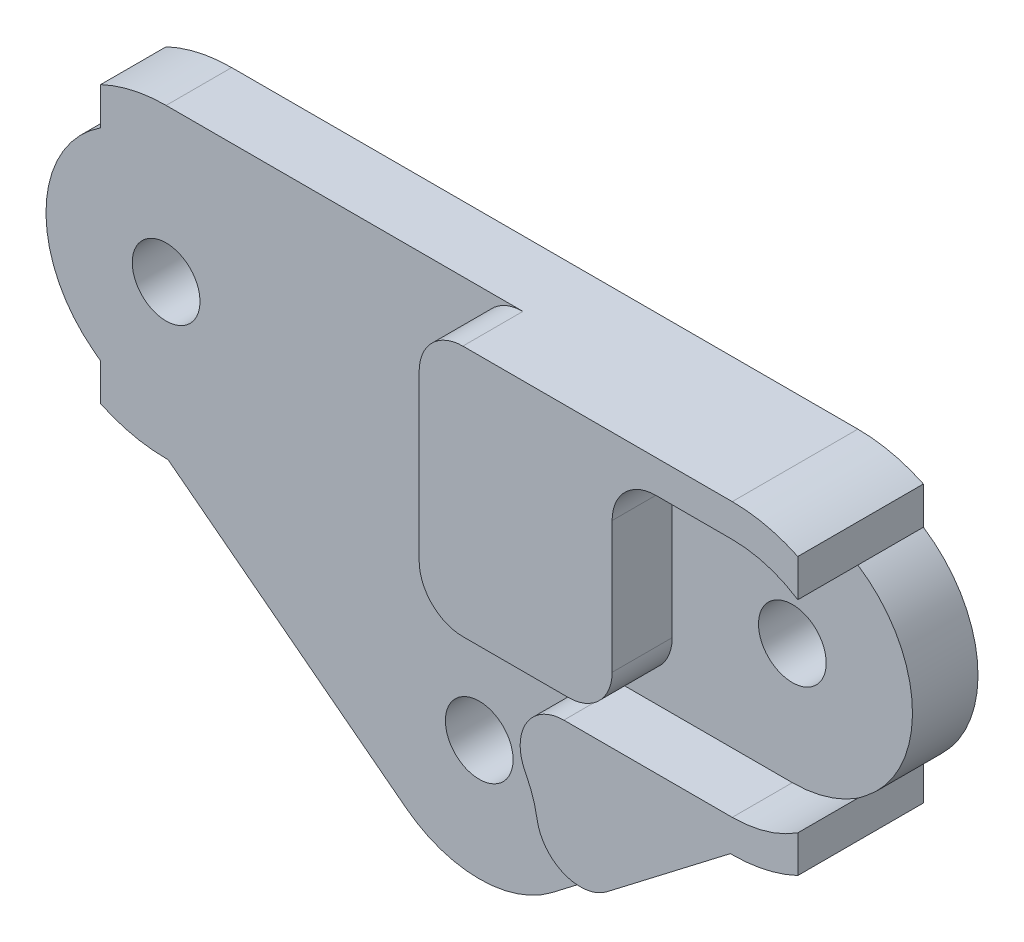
SolidWorks part; units mm, degrees
ref_plane "Front Plane" through (0, 0, 0) normal (0, 0, 1) x (1, 0, 0)
ref_plane "Top Plane" through (0, 0, 0) normal (0, 1, 0) x (1, 0, 0)
ref_plane "Right Plane" through (0, 0, 0) normal (1, 0, 0) x (0, 0, -1)
sketch "Sketch1" plane through (0, 0, 0) normal (0, 0, 1) x (1, 0, 0)
  line L0 (0, 0) -> (14.3333, 0) construction
  line L1 (0, 0) -> (0, -11) construction
  line L2 (14.3333, 5.5) -> (-14.3333, 5.5)
  line L3 (3.3485, -15.3632) -> (17.6818, -4.3632)
  line L4 (-3.3485, -15.3632) -> (-17.6818, -4.3632)
  circle A0 centre (14.3333, 0) radius 1.55
  circle A1 centre (0, -11) radius 1.55
  circle A2 centre (-14.3333, 0) radius 1.55
  arc A3 (14.3333, 5.5) -> (17.6818, -4.3632) centre (14.3333, 0) cw
  arc A4 (-3.3485, -15.3632) -> (3.3485, -15.3632) centre (0, -11) ccw
  arc A5 (-14.3333, 5.5) -> (-17.6818, -4.3632) centre (-14.3333, 0) ccw
  point P15 (0, 5.5)
  dimension "D1" = 3.1
  dimension "D2" = 28.6667
  dimension "D3" = 11
  dimension "D4" = 5.5
extrude "Plate" add sketch "Sketch1" along normal blind 3
sketch "Sketch2" plane through (0, 0, 3) normal (0, 0, 1) x (1, 0, 0)
  line L0 (14.3333, 5.5) -> (14.3333, 0) construction
  line L2 (14.3333, 5.5) -> (-14.3333, 5.5) construction
  line L3 (0, 7) -> (14.3333, 7)
  line L4 (0, 5.5) -> (14.3333, 5.5)
  line L5 (17.3333, 6.3246) -> (17.3333, 4.6098)
  line L6 (14.3333, 0) -> (17.3333, 4.6098) construction
  line L7 (0, 5.5) -> (0, -16.5) construction
  line L9 (17.3333, -4.6098) -> (17.3333, -6.3246)
  line L11 (17.3333, -6.3246) -> (17.3785, -5.773)
  line L12 (14.3333, -7) -> (14.246, -7)
  line L13 (3.3485, -15.3632) -> (17.6818, -4.3632) construction
  line L14 (14.3333, -5.5) -> (14.246, -7)
  line L15 (-14.3333, 0) -> (-17.3333, 4.6098) construction
  line L16 (-14.3333, 5.5) -> (-14.3333, 0) construction
  line L17 (-14.3333, -5.5) -> (-14.246, -7)
  line L18 (-14.3333, -7) -> (-14.246, -7)
  line L19 (-17.3333, -6.3246) -> (-17.3785, -5.773)
  line L20 (-17.3333, -4.6098) -> (-17.3333, -6.3246)
  line L21 (-17.3333, 6.3246) -> (-17.3333, 4.6098)
  line L22 (0, 5.5) -> (-14.3333, 5.5)
  line L23 (0, 7) -> (-14.3333, 7)
  arc A0 (17.6818, -4.3632) -> (14.3333, 5.5) centre (14.3333, 0) ccw construction
  arc A1 (14.3333, 5.5) -> (17.3333, 4.6098) centre (14.3333, 0) cw
  arc A2 (14.3333, 7) -> (17.3333, 6.3246) centre (14.3333, 0) cw
  circle A3 centre (14.3333, 0) radius 5.5 construction
  arc A4 (17.3333, -4.6098) -> (14.3333, -5.5) centre (14.3333, 0) cw
  arc A5 (-3.3485, -15.3632) -> (3.3485, -15.3632) centre (0, -11) ccw construction
  arc A6 (17.3333, -6.3246) -> (14.3333, -7) centre (14.3333, 0) cw
  circle A7 centre (-14.3333, 0) radius 5.5 construction
  arc A8 (-17.3333, -6.3246) -> (-14.3333, -7) centre (-14.3333, 0) ccw
  arc A9 (-17.3333, -4.6098) -> (-14.3333, -5.5) centre (-14.3333, 0) ccw
  arc A10 (-14.3333, 7) -> (-17.3333, 6.3246) centre (-14.3333, 0) ccw
  arc A11 (-14.3333, 5.5) -> (-17.3333, 4.6098) centre (-14.3333, 0) ccw
  dimension "D4" = 1.5
  dimension "D1" = 1.5
  dimension "D2" = 3
  dimension "D3" = 3
extrude "Flange" add sketch "Sketch2" against normal up to surface (3 mm away)
sketch "Sketch3" plane through (0, 0, 3) normal (0, 0, 1) x (1, 0, 0)
  line L0 (5.4825, -11) -> (5.4825, -13.7255)
  line L1 (3.3485, -15.3632) -> (14.246, -7) construction
  line L2 (5.4825, -13.7255) -> (14.246, -7)
  line L3 (17.3333, -4.6307) -> (17.3333, -6.3246) construction
  line L4 (17.3333, -4.6307) -> (17.3333, -6.3246)
  line L5 (14.246, -7) -> (14.3333, -7)
  line L9 (17.3333, 6.3246) -> (17.3333, 4.6098) construction
  line L10 (17.3333, 6.3246) -> (17.3333, 4.6098)
  line L11 (14.3333, 7) -> (0, 7)
  line L12 (14.3333, 7) -> (-14.3333, 7) construction
  line L13 (0, 0) -> (8.8333, 0) construction
  line L14 (14.3333, -5.5175) -> (0, -5.5175)
  line L15 (14.3333, 5.5) -> (8.8333, 5.5)
  line L17 (8.8333, 5.5) -> (8.8333, -4.5175)
  line L18 (8.8333, -4.5175) -> (0, -4.5175)
  line L19 (0, -4.5175) -> (0, 7)
  circle A0 centre (14.3333, 0) radius 5.5 construction
  circle A1 centre (0, -11) radius 5.4825 construction
  arc A3 (0, -5.5175) -> (5.4825, -11) centre (0, -11) cw
  arc A4 (14.3333, -7) -> (17.3333, -6.3246) centre (14.3333, 0) ccw construction
  arc A5 (14.3333, -7) -> (17.3333, -6.3246) centre (14.3333, 0) ccw
  arc A6 (17.3333, -4.6307) -> (14.3333, -5.5175) centre (14.3333, 0) cw
  arc A9 (17.3333, 6.3246) -> (14.3333, 7) centre (14.3333, 0) ccw construction
  arc A10 (17.3333, 6.3246) -> (14.3333, 7) centre (14.3333, 0) ccw
  arc A11 (14.3333, 5.5) -> (17.3333, 4.6098) centre (14.3333, 0) cw
  point P39 (0, -11)
  dimension "D1" = 1
extrude "Extrude" add sketch "Sketch3" along normal blind 2.75
fillet "Fillet1" radius 2 6 edges at (0, -4.5175, 4.375) (0, -5.5175, 4.375) (5.4825, -13.7255, 4.375) (8.8333, -4.5175, 4.375) (8.8333, 5.5, 4.375)
